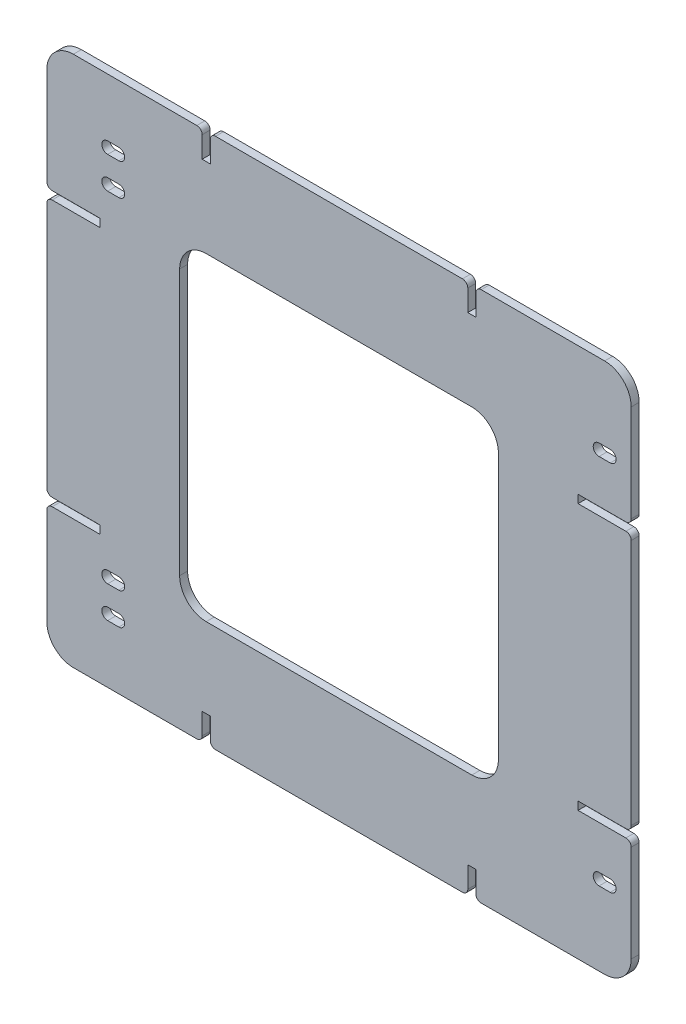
SolidWorks part; units mm, degrees
ref_plane "前视基准面" through (0, 0, 0) normal (0, 0, 1) x (1, 0, 0)
ref_plane "上视基准面" through (0, 0, 0) normal (0, 1, 0) x (1, 0, 0)
ref_plane "右视基准面" through (0, 0, 0) normal (1, 0, 0) x (0, 0, -1)
sketch "草图1" plane through (0, 0, 0) normal (0, 0, 1) x (1, 0, 0)
  line L1 (-110, 100) -> (110, 100)
  line L2 (-110, 100) -> (-110, -100)
  line L3 (-110, -100) -> (110, -100)
  line L4 (110, 100) -> (110, -100)
  line L5 (-110, 100) -> (110, -100) construction
  line L6 (-110, -100) -> (110, 100) construction
  point P0 (0, 0)
  dimension "D1" = 200
  dimension "D2" = 220
extrude "凸台-拉伸1" add sketch "草图1" along normal blind 3
hole_wizard "Ø4.2 (4.2) 直径孔1" positions "草图2" profile "草图3" hole size "Ø4.2" standard "GB"
sketch "草图2" plane through (0, 0, 3) normal (0, 0, 1) x (1, 0, 0)
  point P0 (-85, 76)
  point P3 (-85, 64)
  point P12 (-85, -76)
  point P15 (-85, -64)
  point P26 (100, -70)
  point P29 (100, 70)
sketch "草图3" plane through (-85, 76, 3) normal (1, 0, 0) x (0, -1, 0)
  line L0 (0, 0) -> (0, 3)
  line L1 (0, 3) -> (2.1, 3)
  line L2 (2.1, 3) -> (2.1, 0)
  line L5 (2.1, 0) -> (0, 0)
  line L11 (0, -6.35) -> (0, 107.95) construction
  dimension "通孔孔直径" = 4.2
  dimension "通孔孔深度" = 3
fillet "圆角1" radius 10 4 edges at (110, -100, 1.5) (-110, 100, 1.5) (110, 100, 1.5) (-110, -100, 1.5)
sketch "草图4" plane through (0, 0, 3) normal (0, 0, 1) x (1, 0, 0)
  line L1 (-60, -60) -> (60, -60)
  line L2 (-60, -60) -> (-60, 60)
  line L3 (-60, 60) -> (60, 60)
  line L4 (60, -60) -> (60, 60)
  line L5 (-60, -60) -> (60, 60) construction
  line L6 (-60, 60) -> (60, -60) construction
  point P0 (0, 0)
  dimension "D1" = 120
  dimension "D2" = 120
extrude "切除-拉伸1" cut sketch "草图4" against normal blind 3
fillet "圆角2" radius 10 4 edges at (-60, 60, 1.5) (60, 60, 1.5) (60, -60, 1.5) (-60, -60, 1.5)
sketch "草图5" plane through (0, 0, 3) normal (0, 0, 1) x (1, 0, 0)
  line L0 (-110, 90) -> (-110, -90) construction
  line L1 (-130, 51.525) -> (-90, 51.525)
  line L2 (-130, 51.525) -> (-130, 48.475)
  line L3 (-130, 48.475) -> (-90, 48.475)
  line L4 (-90, 51.525) -> (-90, 48.475)
  line L5 (-130, 51.525) -> (-90, 48.475) construction
  line L6 (-130, 48.475) -> (-90, 51.525) construction
  line L7 (-100, -100) -> (100, -100) construction
  line L8 (-130, -48.475) -> (-90, -48.475)
  line L9 (-130, -48.475) -> (-130, -51.525)
  line L10 (-130, -51.525) -> (-90, -51.525)
  line L11 (-90, -48.475) -> (-90, -51.525)
  line L12 (-130, -48.475) -> (-90, -51.525) construction
  line L13 (-130, -51.525) -> (-90, -48.475) construction
  line L14 (-51.525, -110) -> (-48.475, -110)
  line L15 (-51.525, -110) -> (-51.525, -90)
  line L16 (-51.525, -90) -> (-48.475, -90)
  line L17 (-48.475, -110) -> (-48.475, -90)
  line L18 (-51.525, -110) -> (-48.475, -90) construction
  line L19 (-51.525, -90) -> (-48.475, -110) construction
  line L20 (-60, 0) -> (60, 0) construction
  line L21 (48.475, -110) -> (51.525, -110)
  line L22 (48.475, -110) -> (48.475, -90)
  line L23 (48.475, -90) -> (51.525, -90)
  line L24 (51.525, -110) -> (51.525, -90)
  line L25 (48.475, -110) -> (51.525, -90) construction
  line L26 (48.475, -90) -> (51.525, -110) construction
  line L27 (-60, 50) -> (-60, -50) construction
  line L28 (60, -50) -> (60, 50) construction
  line L29 (0, 60) -> (0, -60) construction
  line L32 (130, -51.525) -> (90, -48.475) construction
  line L33 (130, -48.475) -> (90, -51.525) construction
  line L34 (130, 48.475) -> (90, 51.525) construction
  line L35 (130, 51.525) -> (90, 48.475) construction
  line L36 (90, -48.475) -> (90, -51.525)
  line L37 (130, -51.525) -> (90, -51.525)
  line L38 (130, -48.475) -> (130, -51.525)
  line L39 (130, -48.475) -> (90, -48.475)
  line L40 (90, 51.525) -> (90, 48.475)
  line L41 (130, 48.475) -> (90, 48.475)
  line L42 (130, 51.525) -> (130, 48.475)
  line L43 (130, 51.525) -> (90, 51.525)
  line L44 (48.475, 90) -> (51.525, 110) construction
  line L45 (48.475, 110) -> (51.525, 90) construction
  line L46 (-51.525, 90) -> (-48.475, 110) construction
  line L47 (-51.525, 110) -> (-48.475, 90) construction
  line L48 (51.525, 110) -> (51.525, 90)
  line L49 (48.475, 90) -> (51.525, 90)
  line L50 (48.475, 110) -> (48.475, 90)
  line L51 (48.475, 110) -> (51.525, 110)
  line L52 (-48.475, 110) -> (-48.475, 90)
  line L53 (-51.525, 90) -> (-48.475, 90)
  line L54 (-51.525, 110) -> (-51.525, 90)
  line L55 (-51.525, 110) -> (-48.475, 110)
  line L56 (50, 60) -> (-50, 60) construction
  line L57 (-50, -60) -> (50, -60) construction
  point P0 (-110, 50)
  point P7 (-110, -50)
  point P12 (-50, -100)
  point P19 (50, -100)
  point P45 (110, -50)
  point P46 (110, 50)
  point P55 (50, 100)
  point P56 (-50, 100)
  dimension "D1" = 40
  dimension "D2" = 40
  dimension "D3" = 20
  dimension "D4" = 20
  dimension "D5" = 3.05
  dimension "D6" = 3.05
  dimension "D7" = 3.05
  dimension "D8" = 3.05
  dimension "D9" = 100
  dimension "D10" = 50
  dimension "D11" = 100
  dimension "D12" = 50
extrude "切除-拉伸2" cut sketch "草图5" against normal blind 3
fillet "圆角4" radius 2 8 edges at (-110, -51.525, 1.5) (-110, -48.475, 1.5) (-48.475, -100, 1.5) (-51.525, -100, 1.5) (51.525, -100, 1.5) (48.475, -100, 1.5) (-110, 48.475, 1.5) (-110, 51.525, 1.5)
fillet "圆角5" radius 2 8 edges at (48.475, 100, 1.5) (51.525, 100, 1.5) (-48.475, 100, 1.5) (-51.525, 100, 1.5) (110, -51.525, 1.5) (110, -48.475, 1.5) (110, 48.475, 1.5) (110, 51.525, 1.5)
sketch "草图6" plane through (0, 0, 3) normal (0, 0, 1) x (1, 0, 0)
  line L0 (-87.1, 76) -> (-82.9, 76) construction
  line L1 (-87.1, 78.2) -> (-82.9, 78.2)
  line L2 (-87.1, 73.8) -> (-82.9, 73.8)
  line L3 (97.9, 70) -> (102.1, 70) construction
  line L4 (97.9, 72.2) -> (102.1, 72.2)
  line L5 (97.9, 67.8) -> (102.1, 67.8)
  line L6 (97.9, -70) -> (102.1, -70) construction
  line L7 (97.9, -67.8) -> (102.1, -67.8)
  line L8 (97.9, -72.2) -> (102.1, -72.2)
  line L9 (-87.1, -64) -> (-82.9, -64) construction
  line L10 (-87.1, -61.8) -> (-82.9, -61.8)
  line L11 (-87.1, -66.2) -> (-82.9, -66.2)
  line L12 (-87.1, -76) -> (-82.9, -76) construction
  line L13 (-87.1, -73.8) -> (-82.9, -73.8)
  line L14 (-87.1, -78.2) -> (-82.9, -78.2)
  line L15 (-87.1, 64) -> (-82.9, 64) construction
  line L16 (-87.1, 66.2) -> (-82.9, 66.2)
  line L17 (-87.1, 61.8) -> (-82.9, 61.8)
  circle A0 centre (-85, 76) radius 2.1 construction
  arc A1 (-87.1, 78.2) -> (-87.1, 73.8) centre (-87.1, 76) ccw
  arc A2 (-82.9, 73.8) -> (-82.9, 78.2) centre (-82.9, 76) ccw
  circle A3 centre (100, 70) radius 2.1 construction
  arc A4 (97.9, 72.2) -> (97.9, 67.8) centre (97.9, 70) ccw
  arc A5 (102.1, 67.8) -> (102.1, 72.2) centre (102.1, 70) ccw
  circle A6 centre (100, -70) radius 2.1 construction
  arc A7 (97.9, -67.8) -> (97.9, -72.2) centre (97.9, -70) ccw
  arc A8 (102.1, -72.2) -> (102.1, -67.8) centre (102.1, -70) ccw
  circle A9 centre (-85, -64) radius 2.1 construction
  arc A10 (-87.1, -61.8) -> (-87.1, -66.2) centre (-87.1, -64) ccw
  arc A11 (-82.9, -66.2) -> (-82.9, -61.8) centre (-82.9, -64) ccw
  circle A12 centre (-85, -76) radius 2.1 construction
  arc A13 (-87.1, -73.8) -> (-87.1, -78.2) centre (-87.1, -76) ccw
  arc A14 (-82.9, -78.2) -> (-82.9, -73.8) centre (-82.9, -76) ccw
  circle A15 centre (-85, 64) radius 2.1 construction
  arc A16 (-87.1, 66.2) -> (-87.1, 61.8) centre (-87.1, 64) ccw
  arc A17 (-82.9, 61.8) -> (-82.9, 66.2) centre (-82.9, 64) ccw
  point P5 (-85, 76)
  point P15 (100, 70)
  point P20 (100, -70)
  point P30 (-85, -64)
  point P40 (-85, -76)
  point P50 (-85, 64)
  dimension "D1" = 2.2
  dimension "D2" = 2.2
  dimension "D3" = 2.2
  dimension "D4" = 2.2
  dimension "D5" = 2.2
  dimension "D6" = 2.2
extrude "切除-拉伸3" cut sketch "草图6" against normal blind 10
